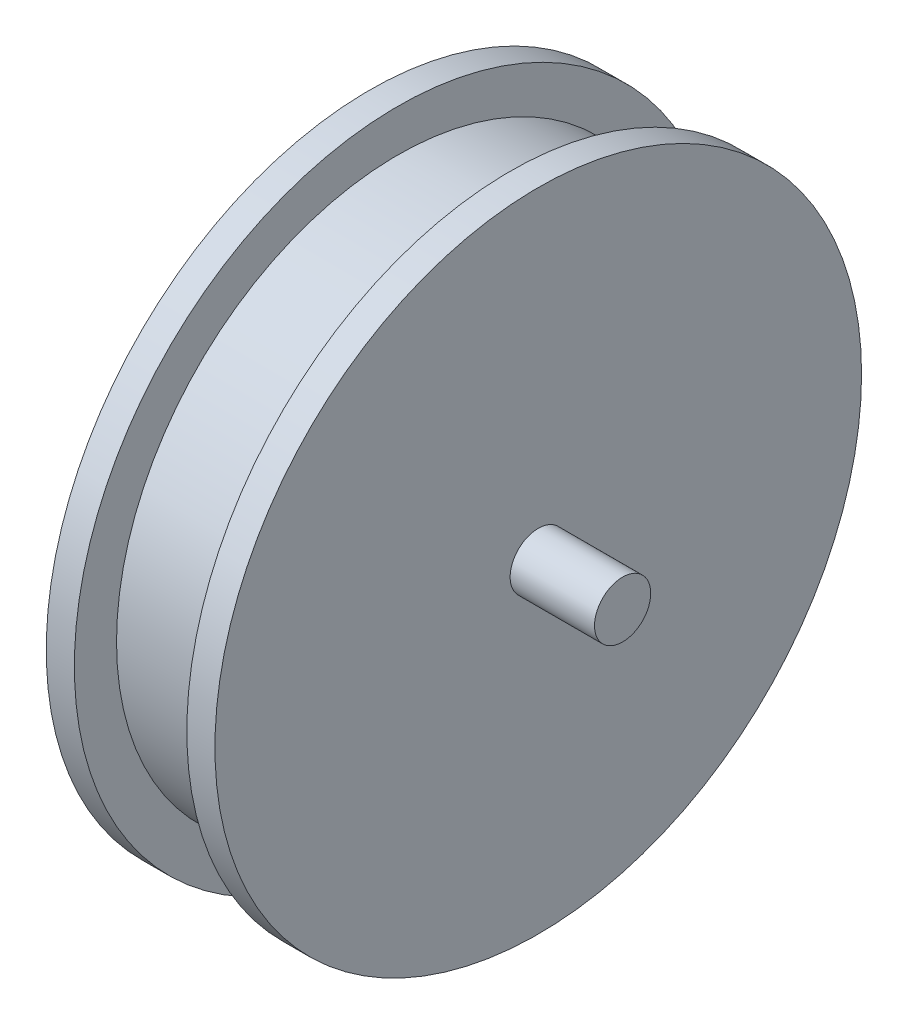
SolidWorks part; units mm, degrees
ref_plane "前视基准面" through (0, 0, 0) normal (0, 0, 1) x (1, 0, 0)
ref_plane "上视基准面" through (0, 0, 0) normal (0, 1, 0) x (1, 0, 0)
ref_plane "右视基准面" through (0, 0, 0) normal (1, 0, 0) x (0, 0, -1)
sketch "草图1" plane through (0, 0, 0) normal (1, 0, 0) x (0, 0, -1)
  circle A0 centre (0, 0) radius 10
  dimension "D1" = 20
extrude "凸台-拉伸1" add sketch "草图1" along normal mid plane 6
sketch "草图2" plane through (3, 0, 0) normal (1, 0, 0) x (0, 0, -1)
  circle A0 centre (0, 0) radius 10 construction
  circle A1 centre (0, 0) radius 10
  circle A4 centre (0, 0) radius 11.5
  circle A5 centre (0, 0) radius 11.5
  dimension "D1" = 1.5
extrude "凸台-拉伸2" add sketch "草图2" against normal blind 1
sketch "草图3" plane through (3, 0, 0) normal (1, 0, 0) x (0, 0, -1)
  circle A0 centre (0, 0) radius 1
  dimension "D1" = 2
extrude "凸台-拉伸3" add sketch "草图3" along normal blind 3
mirror "镜向1" about plane through (0, 0, 0) normal (1, 0, 0) of "凸台-拉伸2", "凸台-拉伸3"
